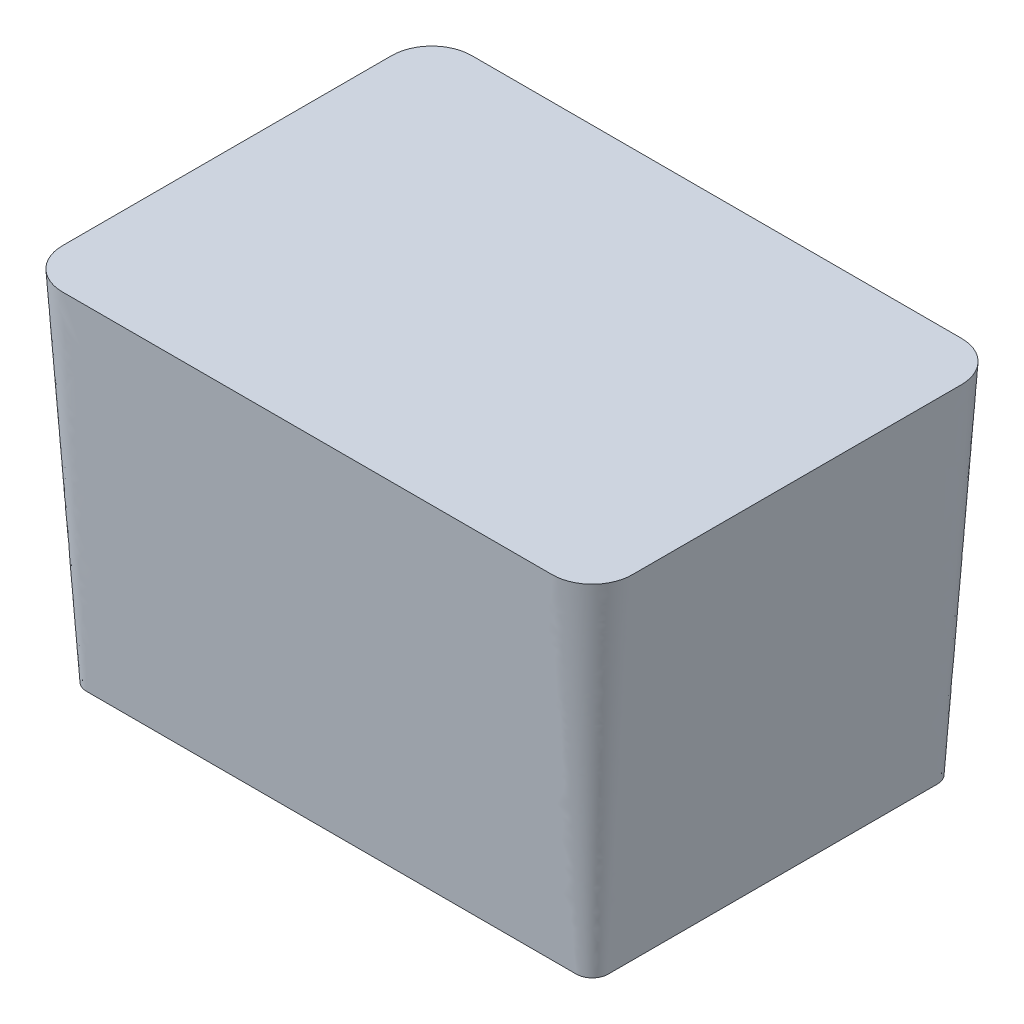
SolidWorks part; units mm, degrees
ref_plane "Front" through (0, 0, 0) normal (0, 0, 1) x (1, 0, 0)
ref_plane "Top" through (0, 0, 0) normal (0, 1, 0) x (1, 0, 0)
ref_plane "Right" through (0, 0, 0) normal (1, 0, 0) x (0, 0, -1)
sketch "Sketch1" plane through (0, 0, 0) normal (0, 1, 0) x (1, 0, 0)
  line L1 (193.675, 142.875) -> (-193.675, 142.875)
  line L2 (206.375, 130.175) -> (206.375, -130.175)
  line L3 (193.675, -142.875) -> (-193.675, -142.875)
  line L4 (-206.375, 130.175) -> (-206.375, -130.175)
  line L5 (206.375, 142.875) -> (-206.375, -142.875) construction
  line L6 (206.375, -142.875) -> (-206.375, 142.875) construction
  arc A0 (193.675, 142.875) -> (206.375, 130.175) centre (193.675, 130.175) cw
  arc A1 (206.375, -130.175) -> (193.675, -142.875) centre (193.675, -130.175) cw
  arc A2 (-193.675, -142.875) -> (-206.375, -130.175) centre (-193.675, -130.175) cw
  arc A3 (-193.675, 142.875) -> (-206.375, 130.175) centre (-193.675, 130.175) ccw
  point P0 (0, 0)
  dimension "D3" = 12.7
  dimension "D1" = 285.75
  dimension "D2" = 412.75
ref_plane "Plane1" through (0, 283.21, 0) normal (0, 1, 0) x (1, 0, 0)
sketch "Sketch2" plane through (0, 283.21, 0) normal (0, 1, 0) x (1, 0, 0)
  line L8 (193.675, 161.925) -> (-193.675, 161.925)
  line L9 (-225.425, 130.175) -> (-225.425, -130.175)
  line L10 (-193.675, -161.925) -> (193.675, -161.925)
  line L11 (225.425, -130.175) -> (225.425, 130.175)
  line L12 (193.675, 161.925) -> (-193.675, 161.925)
  line L13 (-225.425, 130.175) -> (-225.425, -130.175)
  line L14 (-193.675, -161.925) -> (193.675, -161.925)
  line L15 (225.425, -130.175) -> (225.425, 130.175)
  arc A8 (-193.675, 161.925) -> (-225.425, 130.175) centre (-193.675, 130.175) ccw
  arc A9 (-225.425, -130.175) -> (-193.675, -161.925) centre (-193.675, -130.175) ccw
  arc A10 (193.675, -161.925) -> (225.425, -130.175) centre (193.675, -130.175) ccw
  arc A11 (225.425, 130.175) -> (193.675, 161.925) centre (193.675, 130.175) ccw
  arc A12 (-193.675, 161.925) -> (-225.425, 130.175) centre (-193.675, 130.175) ccw
  arc A13 (-225.425, -130.175) -> (-193.675, -161.925) centre (-193.675, -130.175) ccw
  arc A14 (193.675, -161.925) -> (225.425, -130.175) centre (193.675, -130.175) ccw
  arc A15 (225.425, 130.175) -> (193.675, 161.925) centre (193.675, 130.175) ccw
  dimension "D1" = 19.05
loft "Loft1" add profiles "Sketch1", "Sketch2"
